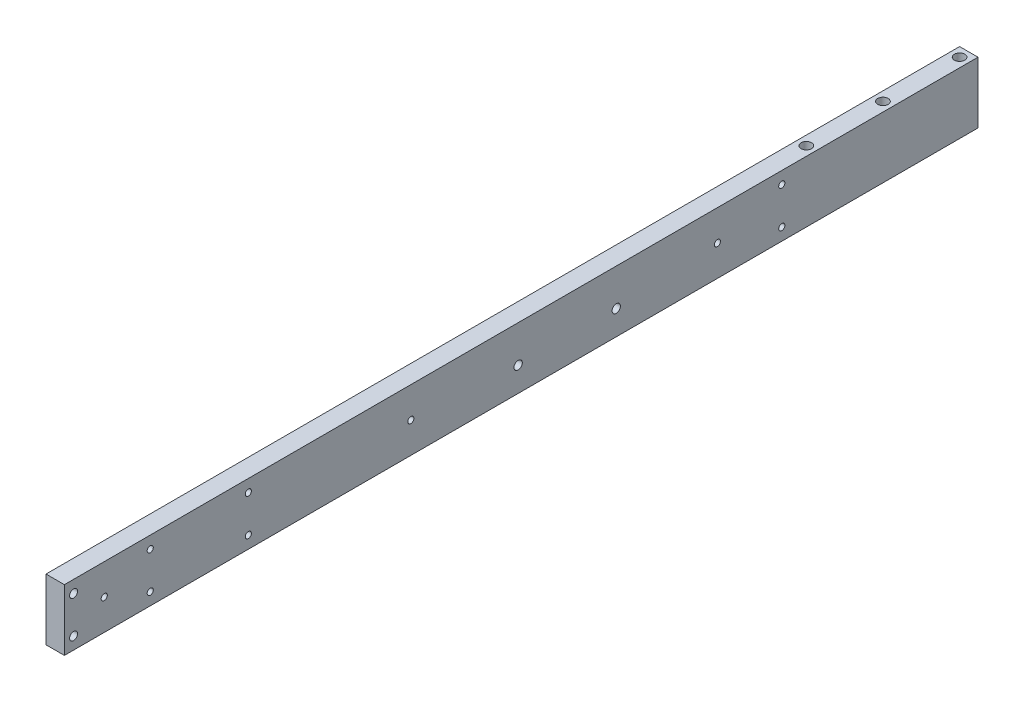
SolidWorks part; units mm, degrees
ref_plane "Plan de face" through (0, 0, 0) normal (0, 0, 1) x (1, 0, 0)
ref_plane "Plan de dessus" through (0, 0, 0) normal (0, 1, 0) x (1, 0, 0)
ref_plane "Plan de droite" through (0, 0, 0) normal (1, 0, 0) x (0, 0, -1)
sketch "Esquisse1" plane through (0, 0, 0) normal (0, 0, 1) x (1, 0, 0)
  line L1 (0, 0) -> (15, 0)
  line L2 (0, 0) -> (0, 50)
  line L3 (0, 50) -> (15, 50)
  line L4 (15, 0) -> (15, 50)
  dimension "D1" = 50
  dimension "D2" = 15
extrude "Extrusion1" add sketch "Esquisse1" against normal blind 745
hole_wizard "Dégagement M81" positions "Esquisse3" profile "Esquisse2" hole size "M8" standard "ISO"
sketch "Esquisse3" plane through (0, 50, 0) normal (0, 1, 0) x (-1, 0, 0)
  line L0 (-15, -745) -> (0, -745) construction
  line L1 (0, -745) -> (0, 0) construction
  point P0 (-7.5, -675)
  point P1 (-7.5, -737.5)
  point P3 (-7.5, -612.5)
  dimension "D1" = 7.5
  dimension "D2" = 7.5
sketch "Esquisse2" plane through (7.5, 50, -675) normal (1, 0, 0) x (0, 0, 1)
  line L0 (0, 0) -> (0, 50)
  line L1 (0, 50) -> (4.25, 50)
  line L2 (4.25, 50) -> (4.25, 0)
  line L5 (4.25, 0) -> (0, 0)
  line L11 (0, -6.35) -> (0, 107.95) construction
  dimension "Diamètre du perçage jusqu'au prochain" = 8.5
  dimension "Profondeur du perçage jusqu'au prochain" = 50
hole_wizard "Chambrage pour axes 6.5 mm" positions "Esquisse5" profile "Esquisse4" counterbore size "6.5" standard "HASCO Métrique"
sketch "Esquisse5" plane through (0, 0, 0) normal (-1, 0, 0) x (0, 0, 1)
  line L0 (0, 50) -> (0, 0) construction
  line L1 (-745, 50) -> (0, 50) construction
  point P0 (-7.5, 10)
  point P1 (-7.5, 40)
  dimension "D1" = 7.5
  dimension "D2" = 10
  dimension "D3" = 30
sketch "Esquisse4" plane through (0, 10, -7.5) normal (0, 1, 0) x (0, 0, 1)
  line L0 (0, 0) -> (0, 15)
  line L1 (0, 15) -> (3.25, 15)
  line L3 (3.25, 15) -> (3.25, 6)
  line L4 (3.25, 6) -> (6, 6)
  line L5 (6, 6) -> (6, 0)
  line L7 (6, 0) -> (0, 0)
  line L11 (0, -6.35) -> (0, 107.95) construction
  dimension "Diamètre du perçage jusqu'au prochain" = 6.5
  dimension "Profondeur du perçage jusqu'au prochain" = 15
  dimension "Diamètre du chambrage" = 12
  dimension "Profondeur du chambrage" = 6
sketch "Esquisse6" plane through (15, 0, 0) normal (1, 0, 0) x (0, 0, -1)
  line L0 (727.5, 32.5) -> (727.5, 27.5) construction
  line L1 (745, 0) -> (745, 50) construction
  line L2 (727.5, 30) -> (734.3956, 30) construction
  line L3 (724.25, 32.5) -> (724.25, 27.5)
  line L4 (730.75, 32.5) -> (730.75, 27.5)
  line L5 (745, 0) -> (0, 0) construction
  circle A0 centre (727.5, 30) radius 3.25 construction
  arc A1 (724.25, 32.5) -> (730.75, 32.5) centre (727.5, 32.5) cw
  arc A2 (724.25, 27.5) -> (730.75, 27.5) centre (727.5, 27.5) ccw
  dimension "D2" = 3.25
  dimension "D1" = 17.5
  dimension "D4" = 5
  dimension "D5" = 30
  dimension "D3" = 3.25
hole_wizard "Trou taraudé M61" positions "Esquisse8" profile "Esquisse7" tap size "M6" standard "ISO"
sketch "Esquisse8" plane through (15, 0, 0) normal (1, 0, 0) x (0, 0, -1)
  line L1 (745, 50) -> (0, 50) construction
  line L2 (0, 0) -> (0, 50) construction
  point P0 (585, 40)
  point P1 (585, 10)
  point P3 (70, 10)
  point P5 (70, 40)
  point P20 (150, 40)
  point P22 (150, 10)
  dimension "D1" = 70
  dimension "D2" = 515
  dimension "D3" = 10
  dimension "D4" = 30
  dimension "D5" = 80
sketch "Esquisse7" plane through (15, 40, -585) normal (0, 1, 0) x (0, 0, -1)
  line L0 (0, 0) -> (0, 15)
  line L1 (0, 15) -> (2.5, 15)
  line L2 (2.5, 15) -> (2.5, 0)
  line L5 (2.5, 0) -> (0, 0)
  line L11 (0, -6.35) -> (0, 107.95) construction
  dimension "Diamètre du trou pour taraudage jusqu'au prochain" = 5
  dimension "Profondeur du trou pour taraudage jusqu'au prochain" = 15
ref_plane "Plan1" through (0, 0, -727.5) normal (0, 0, -1) x (-1, 0, 0)
hole_wizard "Trou taraudé M62" positions "Esquisse10" profile "Esquisse9" tap size "M6" standard "ISO"
sketch "Esquisse10" plane through (0, 0, 0) normal (-1, 0, 0) x (0, 0, 1)
  line L0 (-745, 0) -> (0, 0) construction
  line L1 (0, 50) -> (0, 0) construction
  point P0 (-532.5, 25)
  point P3 (-282.5, 25)
  point P5 (-32.5, 25)
  dimension "D1" = 25
  dimension "D2" = 32.5
sketch "Esquisse9" plane through (0, 25, -532.5) normal (0, 1, 0) x (0, 0, 1)
  line L0 (0, 0) -> (0, 15)
  line L1 (0, 15) -> (2.5, 15)
  line L2 (2.5, 15) -> (2.5, 0)
  line L5 (2.5, 0) -> (0, 0)
  line L11 (0, -6.35) -> (0, 107.95) construction
  dimension "Diamètre du trou pour taraudage jusqu'au prochain" = 5
  dimension "Profondeur du trou pour taraudage jusqu'au prochain" = 15
hole_wizard "Trou taraudé M81" positions "Esquisse12" profile "Esquisse11" tap size "M8" standard "ISO"
sketch "Esquisse12" plane through (15, 0, 0) normal (1, 0, 0) x (0, 0, -1)
  line L0 (745, 0) -> (0, 0) construction
  line L2 (0, 0) -> (0, 50) construction
  point P0 (450, 20)
  point P1 (370, 20)
  dimension "D1" = 20
  dimension "D2" = 80
  dimension "D3" = 370
sketch "Esquisse11" plane through (15, 20, -450) normal (0, 1, 0) x (0, 0, -1)
  line L0 (0, 0) -> (0, 15)
  line L1 (0, 15) -> (3.4, 15)
  line L2 (3.4, 15) -> (3.4, 0)
  line L5 (3.4, 0) -> (0, 0)
  line L11 (0, -6.35) -> (0, 107.95) construction
  dimension "Diamètre du trou pour taraudage jusqu'au prochain" = 6.8
  dimension "Profondeur du trou pour taraudage jusqu'au prochain" = 15
